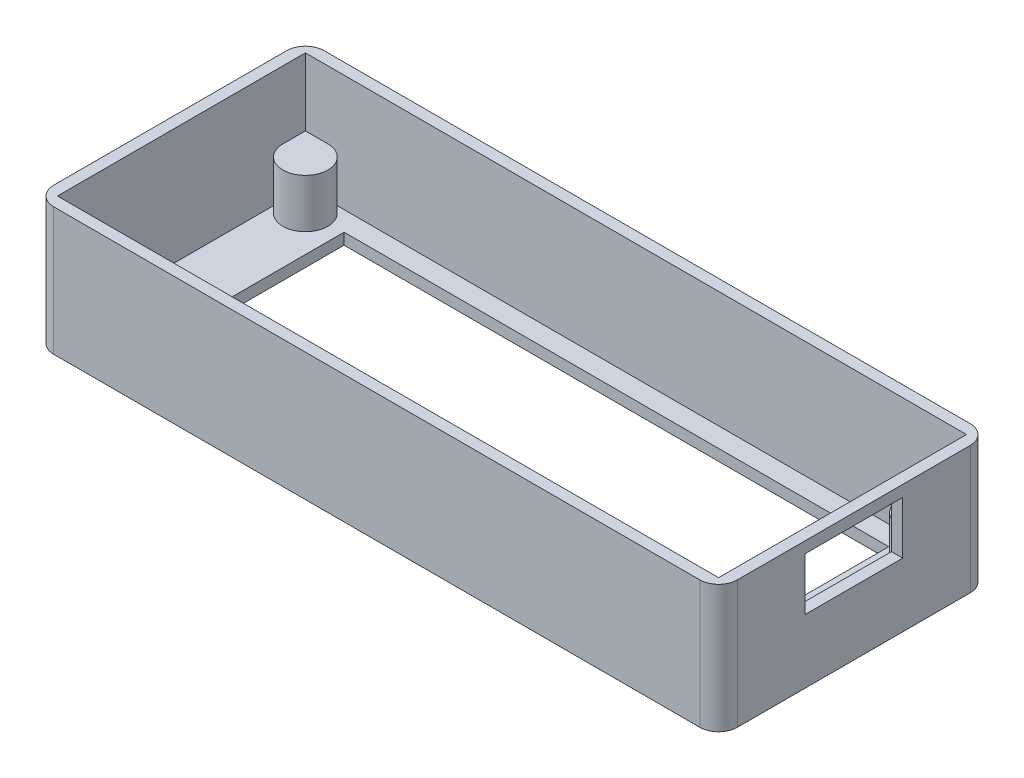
SolidWorks part; units mm, degrees
ref_plane "前视基准面" through (0, 0, 0) normal (0, 0, 1) x (1, 0, 0)
ref_plane "上视基准面" through (0, 0, 0) normal (0, 1, 0) x (1, 0, 0)
ref_plane "右视基准面" through (0, 0, 0) normal (1, 0, 0) x (0, 0, -1)
sketch "草图1" plane through (0, 0, 0) normal (0, 1, 0) x (1, 0, 0)
  line L1 (-45.5, -18) -> (45.5, -18)
  line L2 (-45.5, -18) -> (-45.5, 18)
  line L3 (-45.5, 18) -> (45.5, 18)
  line L4 (45.5, -18) -> (45.5, 18)
  line L5 (-45.5, -18) -> (45.5, 18) construction
  line L6 (-45.5, 18) -> (45.5, -18) construction
  point P0 (0, 0)
  dimension "D1" = 91
  dimension "D2" = 36
extrude "凸台-拉伸1" add sketch "草图1" along normal blind 17
shell "抽壳1" thickness 1.5
fillet "圆角1" radius 2.5 4 edges at (-45.5, 8.5, 18) (-45.5, 8.5, -18) (45.5, 8.5, 18) (45.5, 8.5, -18)
sketch "草图2" plane through (0, 1.5, 0) normal (0, 1, 0) x (1, 0, 0)
  line L1 (-36.25, -13.9) -> (36.25, -13.9)
  line L2 (-36.25, -13.9) -> (-36.25, 13.9)
  line L3 (-36.25, 13.9) -> (36.25, 13.9)
  line L4 (36.25, -13.9) -> (36.25, 13.9)
  line L5 (-36.25, -13.9) -> (36.25, 13.9) construction
  line L6 (-36.25, 13.9) -> (36.25, -13.9) construction
  point P0 (0, 0)
  dimension "D1" = 72.5
  dimension "D2" = 27.8
extrude "切除-拉伸1" cut sketch "草图2" against normal up to next
sketch "草图3" plane through (0, 1.5, 0) normal (0, 1, 0) x (1, 0, 0)
  line L0 (44, 16.5) -> (-44, 16.5) construction
  line L1 (-44, 16.5) -> (-44, -16.5) construction
  line L2 (-44, 16.5) -> (-41, 16.5)
  line L3 (-44, 16.5) -> (-44, 13.5)
  arc A0 (-44, 13.5) -> (-41, 16.5) centre (-41, 13.5) ccw
  dimension "D1" = 6
extrude "凸台-拉伸2" add sketch "草图3" along normal blind 6.5
mirror "镜向1" about plane through (0, 0, 0) normal (1, 0, 0) of "凸台-拉伸2"
mirror "镜向2" about plane through (0, 0, 0) normal (0, 0, 1) of "镜向1", "凸台-拉伸2"
sketch "草图4" plane through (45.5, 0, 0) normal (1, 0, 0) x (0, 0, -1)
  line L0 (-6.5, 15.5) -> (6.5, 15.5)
  line L1 (-6.5, 15.5) -> (-6.5, 8.5)
  line L2 (6.5, 15.5) -> (6.5, 8.5)
  line L3 (-6.5, 8.5) -> (6.5, 8.5)
  line L7 (-15.5, 17) -> (-15.5, 0) construction
  line L9 (-15.5, 17) -> (15.5, 17) construction
  dimension "D1" = 7
  dimension "D2" = 13
  dimension "D3" = 9
  dimension "D4" = 8.5
extrude "切除-拉伸2" cut sketch "草图4" against normal up to next
